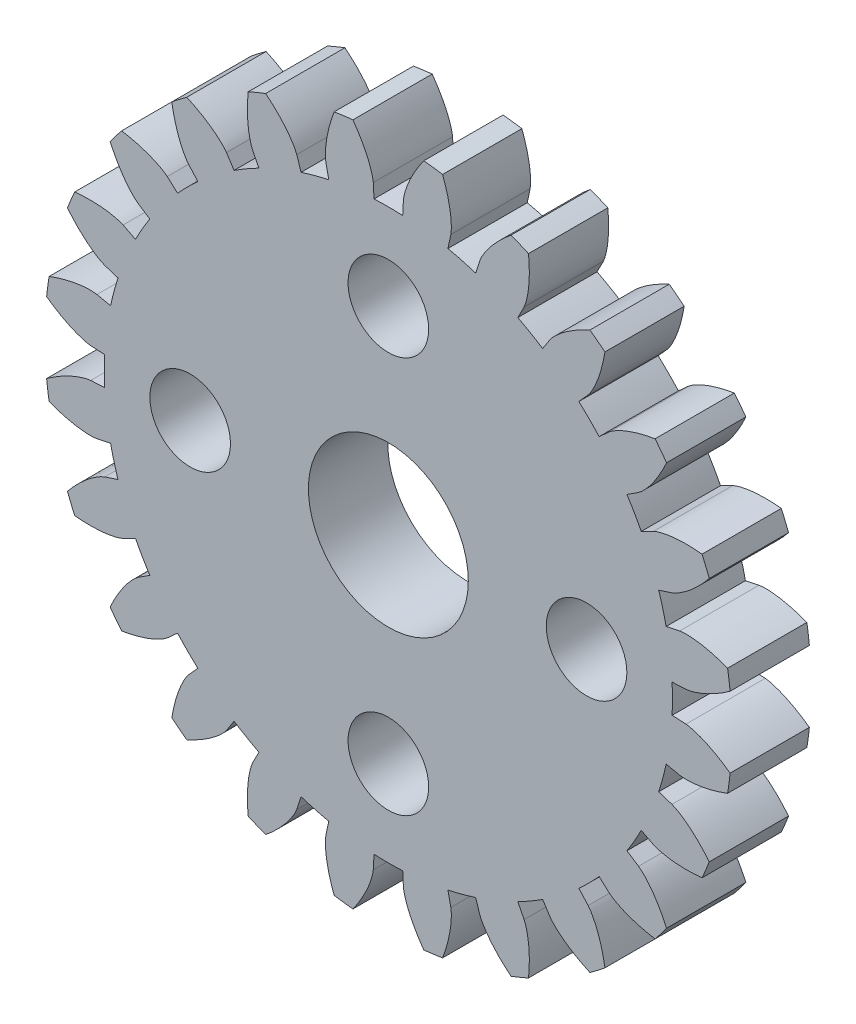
SolidWorks part; units mm, degrees
ref_plane "正面" through (0, 0, 0) normal (0, 0, 1) x (1, 0, 0)
ref_plane "平面" through (0, 0, 0) normal (0, 1, 0) x (1, 0, 0)
ref_plane "右側面" through (0, 0, 0) normal (1, 0, 0) x (0, 0, -1)
sketch "インボリュート スケッチ" plane through (0, 0, 0) normal (0, 0, 1) x (1, 0, 0)
  line L0 (-34.8106, -13.0518) -> (0.5697, -11.2619)
  line L1 (0.5697, -11.2619) -> (-0.5697, 11.2619) construction
  line L2 (0, 0) -> (0, 13) construction
  line L3 (-0.5697, 11.2619) -> (-0.5431, 10.7363)
  line L4 (0, 0) -> (0.5697, -11.2619)
  line L5 (-0.5431, 10.7363) -> (0, 10.7363)
  line L6 (0, 10.7363) -> (0, 0)
  circle A0 centre (0, 0) radius 11.2763 construction
  circle A1 centre (0, 0) radius 12 construction
  circle A2 centre (0, 0) radius 10.75 construction
  circle A3 centre (0, 0) radius 13 construction
  spline S0 degree 4 poles (-0.5697, 11.2619) (-0.574, 11.3046) (-0.5866, 11.3894) (-0.6249, 11.5484) (-0.6996, 11.7771) (-0.8595, 12.1613) (-1.1813, 12.7395) (-1.7152, 13.4541) (-2.5966, 14.3353) (-3.7723, 15.202) (-5.1872, 15.9587) (-6.8096, 16.5558) (-8.4923, 16.9475) (-10.208, 17.1468) (-12.02, 17.1664) (-14.2543, 16.9568) (-16.8688, 16.3668) (-19.7751, 15.2449) (-22.7719, 13.5148) (-25.4876, 11.3728) (-27.8885, 8.8847) (-29.6939, 6.4582) (-31.0213, 4.2351) (-31.9784, 2.3033) (-32.654, 0.7163) (-33.2393, -0.9057) (-33.7343, -2.5583) (-34.2406, -4.6529) (-34.5976, -6.7819) (-34.7866, -8.711) (-34.849, -10.3301) (-34.8576, -11.1858) (-34.8531, -11.7695) (-34.8449, -12.2259) (-34.821, -12.8723) (-34.7957, -13.354) (-34.7427, -14.1461) (-34.6848, -14.7539) (-34.6065, -15.4973) (-34.5193, -16.1547) (-34.4161, -16.8643) (-34.3018, -17.534) (-34.2052, -18.0593) (-34.1373, -18.3928) (-34.1019, -18.5662) knots 0 0 0 0 0 0.002802 0.005604 0.010661 0.015718 0.02996 0.048734 0.068727 0.096889 0.125051 0.153212 0.181374 0.209535 0.237696 0.271429 0.327752 0.384075 0.440398 0.496721 0.553044 0.609367 0.637529 0.66569 0.693852 0.722013 0.750174 0.778336 0.834659 0.86282 0.876901 0.883942 0.890982 0.900036 0.909091 0.920455 0.931818 0.943182 0.954545 0.965909 0.977273 0.988636 1 1 1 1 1 construction
  spline S1 degree 4 poles (-0.5697, 11.2619) (-0.574, 11.3046) (-0.5866, 11.3894) (-0.6249, 11.5484) (-0.6996, 11.7771) (-0.8595, 12.1613) (-1.1813, 12.7395) (-1.7152, 13.4541) (-2.5966, 14.3353) (-3.7723, 15.202) (-5.1872, 15.9587) (-6.8096, 16.5558) (-8.4923, 16.9475) (-10.208, 17.1468) (-12.02, 17.1664) (-14.2543, 16.9568) (-16.8688, 16.3668) (-19.7751, 15.2449) (-22.7719, 13.5148) (-25.4876, 11.3728) (-27.8885, 8.8847) (-29.6939, 6.4582) (-31.0213, 4.2351) (-31.9784, 2.3033) (-32.654, 0.7163) (-33.2393, -0.9057) (-33.7343, -2.5583) (-34.2406, -4.6529) (-34.5976, -6.7819) (-34.7866, -8.711) (-34.849, -10.3301) (-34.8576, -11.1858) (-34.8531, -11.7695) (-34.8449, -12.2259) (-34.8284, -12.6711) (-34.817, -12.926) (-34.8106, -13.0518) knots 0 0 0 0 0 0.002802 0.005604 0.010661 0.015718 0.02996 0.048734 0.068727 0.096889 0.125051 0.153212 0.181374 0.209535 0.237696 0.271429 0.327752 0.384075 0.440398 0.496721 0.553044 0.609367 0.637529 0.66569 0.693852 0.722013 0.750174 0.778336 0.834659 0.86282 0.876901 0.883942 0.890982 0.900036 0.909091 0.909091 0.909091 0.909091 0.909091
  point P6 (-0.7848, 11.9743)
  point P12 (0, 12)
  point P24 (0, 0)
extrude "インボリュート ボス" add sketch "インボリュート スケッチ" along normal blind 3
mirror "インボリュート ミラー" about plane through (0, 0, 3) normal (1, 0, 0)
sketch "歯先円 スケッチ" plane through (0, 0, 3) normal (0, 0, 1) x (1, 0, 0)
  circle A0 centre (0, 0) radius 37.177
  circle A1 centre (0, 0) radius 13
extrude "歯先円 カット" cut sketch "歯先円 スケッチ" against normal through all
sketch "歯分割 スケッチ" plane through (0, 0, 3) normal (0, 0, 1) x (1, 0, 0)
  line L0 (-1.6968, 12.8888) -> (0, 0)
  line L1 (0, 0) -> (1.6968, 12.8888)
  line L2 (0, 0) -> (0, 12) construction
  arc A0 (-1.6968, 12.8888) -> (1.6968, 12.8888) centre (0, 0) ccw
  circle A2 centre (0, 0) radius 12 construction
  arc A3 (-1.3415, 12.9306) -> (-5.8908, -11.5887) centre (0, 0) ccw construction
  point P9 (-1.5663, 11.8973)
  point P10 (1.5663, 11.8973)
extrude "歯分割 カット" cut sketch "歯分割 スケッチ" against normal through all
pattern_circular "歯分割 円形コピー" count 24 over 360 about axis through (0, 0, 0) along (0, 0, 1)
sketch "歯底円 スケッチ" plane through (0, 0, 3) normal (0, 0, 1) x (1, 0, 0)
  circle A0 centre (0, 0) radius 10.75
extrude "歯底円 ボス" add sketch "歯底円 スケッチ" against normal through all
sketch "軸 丸穴 スケッチ" plane through (0, 0, 3) normal (0, 0, 1) x (1, 0, 0)
  circle A0 centre (0, 0) radius 3.025
  dimension "D1" = 6.05
extrude "軸 丸穴 カット" cut sketch "軸 丸穴 スケッチ" against normal through all
sketch "軸 キー溝 スケッチ" plane through (0, 0, 3) normal (0, 0, 1) x (1, 0, 0)
  line L2 (-1.5, 3.7081) -> (-1.5, 5.4)
  line L3 (-1.5, 5.4) -> (1.5, 5.4)
  line L4 (1.5, 3.7081) -> (1.5, 5.4)
  arc A0 (-1.5, 3.7081) -> (1.5, 3.7081) centre (0, 0) ccw
  dimension "D1" = 8
  dimension "D2" = 3
  dimension "D3" = 5.4
extrude "軸 キー溝 カット" [suppressed] cut sketch "軸 キー溝 スケッチ" against normal through all
sketch "軸 Dカット スケッチ" plane through (0, 0, 3) normal (0, 0, 1) x (1, 0, 0)
  line L0 (-1.9861, 2) -> (1.9861, 2)
  arc A0 (-2.3948, 1.8069) -> (2.3948, 1.8069) centre (0, 0) ccw
  arc A1 (-1.9861, 2) -> (-2.3948, 1.8069) centre (-2.2361, 2) ccw
  arc A2 (2.3948, 1.8069) -> (1.9861, 2) centre (2.2361, 2) ccw
  dimension "D1" = 6
  dimension "D3" = 0.5
  dimension "D2" = 2
extrude "軸 Dカット カット" [suppressed] cut sketch "軸 Dカット スケッチ" against normal through all
sketch "軸 角穴 スケッチ" plane through (0, 0, 3) normal (0, 0, 1) x (1, 0, 0)
  line L0 (-5.1, 5.1) -> (5.1, 5.1)
  line L1 (-5, -5) -> (5, -5) construction
  line L2 (-5, -5) -> (-5, 5) construction
  line L3 (-5, 5) -> (5, 5) construction
  line L4 (5, -5) -> (5, 5) construction
  line L5 (-5, -5) -> (5, 5) construction
  line L6 (-5, 5) -> (5, -5) construction
  line L7 (5.1, -5.1) -> (5.1, 5.1)
  line L8 (-5.1, -5.1) -> (5.1, -5.1)
  line L9 (-5.1, -5.1) -> (-5.1, 5.1)
  point P0 (0, 0)
  dimension "D1" = 10
  dimension "D2" = 0.1
extrude "軸 角穴 カット" [suppressed] cut sketch "軸 角穴 スケッチ" against normal through all
sketch "フランジ穴 スケッチ" plane through (0, 0, 3) normal (0, 0, 1) x (1, 0, 0)
  circle A0 centre (0, 12) radius 1.6
  circle A1 centre (12, 0) radius 1.6
  circle A2 centre (0, -12) radius 1.6
  circle A3 centre (-12, 0) radius 1.6
  point P12 (0, 0)
  dimension "D2" = 3.2
  dimension "D3" = 12
  dimension "D1" = 4
extrude "フランジ穴 カット" [suppressed] cut sketch "フランジ穴 スケッチ" against normal through all
sketch "合致用スケッチ" plane through (0, 0, 3) normal (0, 0, 1) x (1, 0, 0)
  line L0 (0, 0) -> (0, 12)
  line L1 (0, 0) -> (1.5663, 11.8973)
  circle A2 centre (0, 0) radius 12
sketch "ｽｹｯﾁ1" plane through (0, 0, 3) normal (0, 0, 1) x (1, 0, 0)
  line L0 (0, 0) -> (7.5, 0) construction
  line L1 (0, 0) -> (0, -7.5) construction
  line L2 (0, 0) -> (-7.5, 0) construction
  line L3 (0, 0) -> (0, 7.5) construction
  circle A0 centre (7.5, 0) radius 1.525
  circle A1 centre (0, -7.5) radius 1.525
  circle A2 centre (-7.5, 0) radius 1.525
  circle A3 centre (0, 7.5) radius 1.525
  point P12 (0, 0)
  dimension "D1" = 3.05
  dimension "D2" = 7.5
  dimension "D3" = 4
extrude "ｶｯﾄ - 押し出し1" cut sketch "ｽｹｯﾁ1" against normal through all
equation "\"モジュール\"= 1"
equation "\"基準圧力角\"= 20"
equation "\"歯数\"= 24"
equation "\"基準円直径\"= \"歯数\" * \"モジュール\""
equation "\"基礎円直径\"= \"基準円直径\" * cos ( \"基準圧力角\" )"
equation "\"歯先円直径\"= \"基準円直径\" + 2 * \"モジュール\""
equation "\"歯底円直径\"= \"基準円直径\" - 2.5 * \"モジュール\""
equation "\"D1@インボリュート スケッチ\" = \"基礎円直径\""
equation "\"D2@インボリュート スケッチ\" = \"基準円直径\""
equation "\"D3@インボリュート スケッチ\" = \"歯底円直径\""
equation "\"D4@インボリュート スケッチ\" = \"歯先円直径\""
equation "\"D5@インボリュート スケッチ\" = Pi * \"モジュール\" / 4"
equation "\"D1@歯先円 スケッチ\" = \"歯先円直径\""
equation "\"D1@歯分割 スケッチ\" = \"基準円直径\""
equation "\"D2@歯分割 スケッチ\" = PI * \"モジュール\""
equation "\"D1@歯分割 円形コピー\" = \"歯数\""
equation "\"D1@歯底円 スケッチ\" = \"歯底円直径\""
equation "\"板厚\"= 3"
equation "\"D1@インボリュート ボス\"=\"板厚\""
equation "\"D1@合致用スケッチ\" = \"基準円直径\""
equation "\"D2@合致用スケッチ\"=180/\"歯数\""
